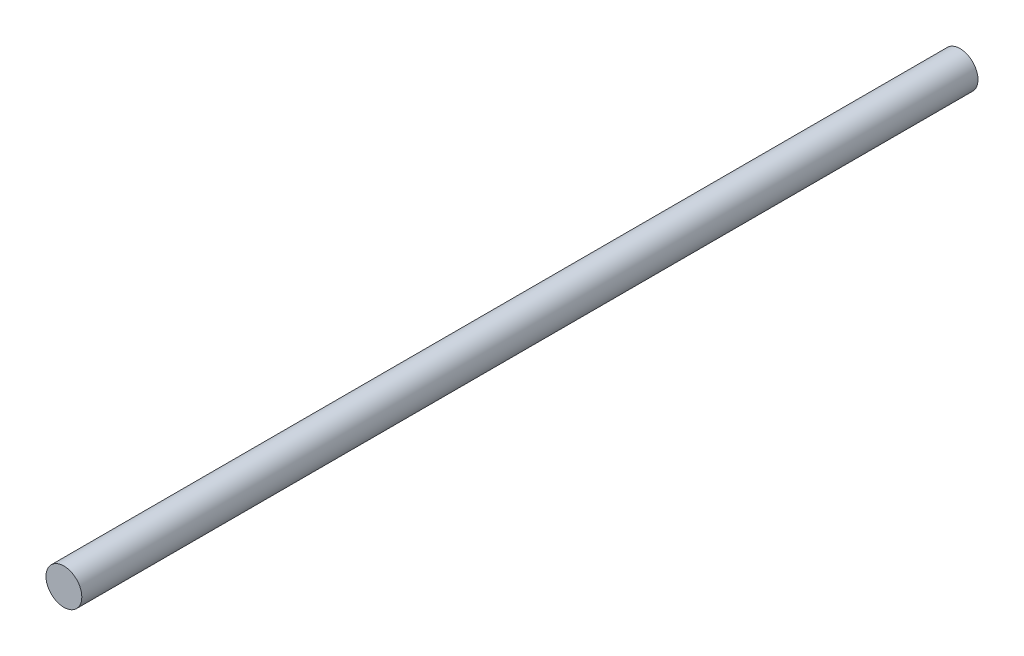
SolidWorks part; units mm, degrees
ref_plane "Piano frontale" through (0, 0, 0) normal (0, 0, 1) x (1, 0, 0)
ref_plane "Piano superiore" through (0, 0, 0) normal (0, 1, 0) x (1, 0, 0)
ref_plane "Piano destro" through (0, 0, 0) normal (1, 0, 0) x (0, 0, -1)
sketch "Schizzo1" plane through (0, 0, 0) normal (0, 0, 1) x (1, 0, 0)
  circle A0 centre (0, 0) radius 4
  dimension "D1" = 8
extrude "Estrusione1" add sketch "Schizzo1" against normal blind 200
